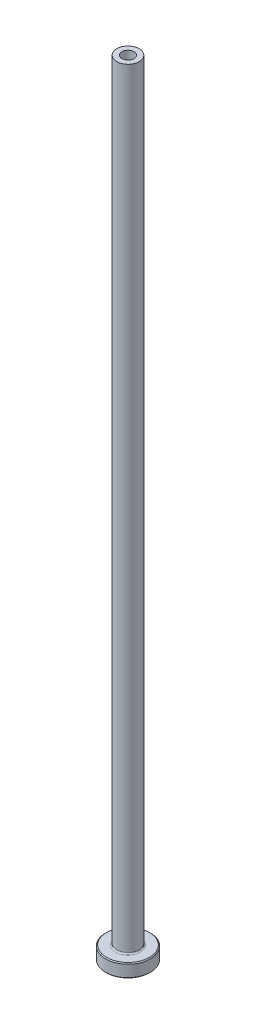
SolidWorks part; units mm, degrees
ref_plane "Front Plane" through (0, 0, 0) normal (0, 0, 1) x (1, 0, 0)
ref_plane "Top Plane" through (0, 0, 0) normal (0, 1, 0) x (1, 0, 0)
ref_plane "Right Plane" through (0, 0, 0) normal (1, 0, 0) x (0, 0, -1)
sketch "Sketch1" plane through (0, 0, 0) normal (0, 0, 1) x (1, 0, 0)
  line L0 (-1.35, 175) -> (-2.5, 175)
  line L1 (-2.5, 175) -> (-2.5, 3)
  line L2 (-2.5, 3) -> (-5, 3)
  line L3 (-5, 3) -> (-5, 0)
  line L4 (5.5, 0) -> (-5.5, 0) construction
  line L5 (-5, 0) -> (-1.6, 0)
  line L6 (-1.35, 130) -> (-1.35, 175)
  line L7 (0, 92.1877) -> (0, -15.5353) construction
  line L8 (0, -5.5) -> (0, 5.5) construction
  line L9 (-1.35, 130) -> (-1.6, 118)
  line L10 (-1.6, 118) -> (-1.6, 0)
  dimension "D1" = 0.25
  dimension "ID" = 2.7
  dimension "OD" = 5
  dimension "L" = 175
  dimension "H" = 10
  dimension "T" = 3
  dimension "N" = 45
  dimension "D2" = 12
revolve "Revolve1" add sketch "Sketch1" angle 360 about L7
fillet "Fillet1" radius 0.3 1 edges at (0, 3, 2.5)
chamfer "Chamfer1" distance 0.2 angle 45 2 edges at (0, 3, 5) (0, 0, 5)
chamfer "Chamfer3" distance 0.5 angle 45 1 edges at (0, 0, 1.6)
